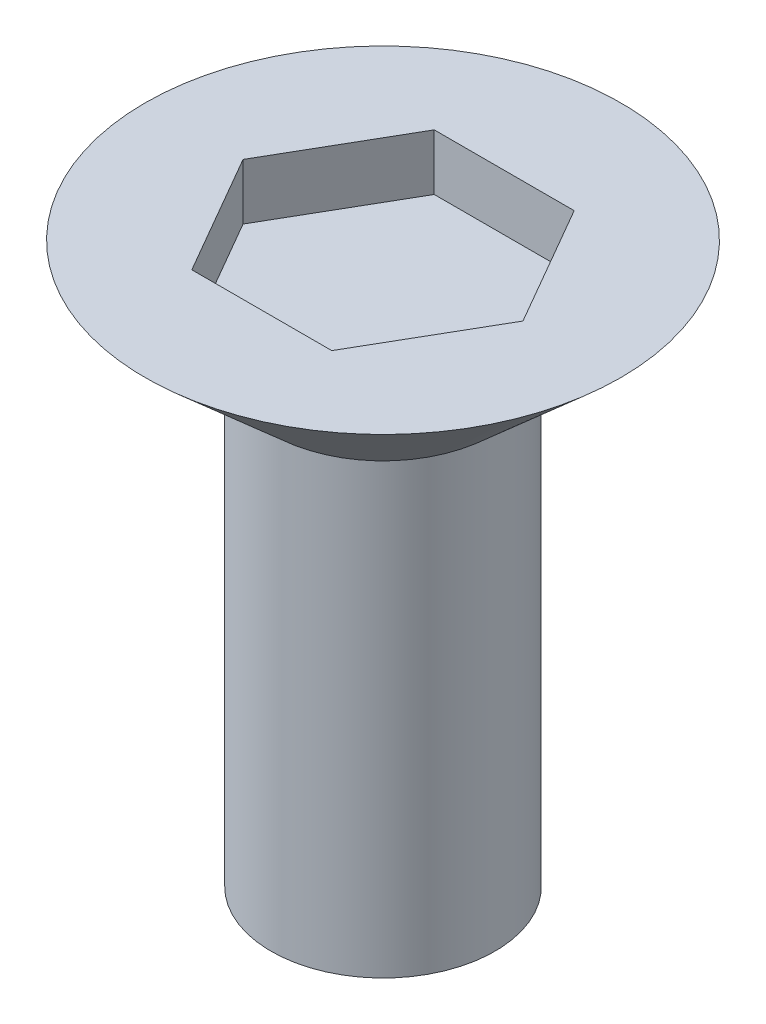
SolidWorks part; units mm, degrees
ref_plane "Alzado" through (0, 0, 0) normal (0, 0, 1) x (1, 0, 0)
ref_plane "Planta" through (0, 0, 0) normal (0, 1, 0) x (1, 0, 0)
ref_plane "Vista lateral" through (0, 0, 0) normal (1, 0, 0) x (0, 0, -1)
sketch "Croquis1" plane through (0, 0, 0) normal (0, 0, 1) x (1, 0, 0)
  line L0 (-8.5, 20) -> (0, 20)
  line L1 (-8.5, 20) -> (-4, 16)
  line L2 (-4, 16) -> (-4, 0)
  line L3 (-4, 0) -> (0, 0)
  line L4 (0, 20) -> (0, 0) construction
  line L5 (0, 20) -> (0, 0)
revolve "Revolución1" add sketch "Croquis1" angle 360 about L4
sketch "Croquis2" plane through (0, 20, 0) normal (0, 1, 0) x (1, 0, 0)
  line L1 (-5, 0) -> (-2.5, 4.3301)
  line L2 (-2.5, 4.3301) -> (2.5, 4.3301)
  line L3 (2.5, 4.3301) -> (5, 0)
  line L4 (5, 0) -> (2.5, -4.3301)
  line L5 (2.5, -4.3301) -> (-2.5, -4.3301)
  line L6 (-2.5, -4.3301) -> (-5, 0)
extrude "Cortar-Extruir1" cut sketch "Croquis2" against normal blind 2
